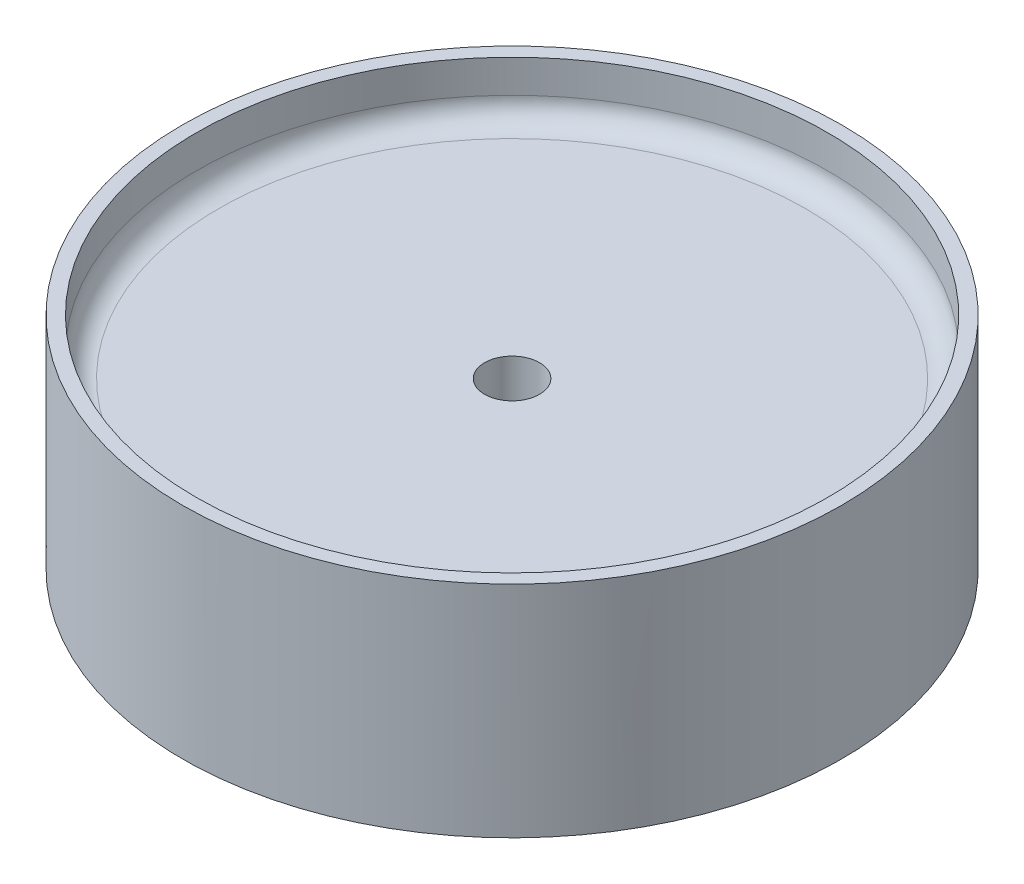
SolidWorks part; units mm, degrees
ref_plane "Front Plane" through (0, 0, 0) normal (0, 0, 1) x (1, 0, 0)
ref_plane "Top Plane" through (0, 0, 0) normal (0, 1, 0) x (1, 0, 0)
ref_plane "Right Plane" through (0, 0, 0) normal (1, 0, 0) x (0, 0, -1)
sketch "Sketch1" plane through (0, 0, 0) normal (0, 1, 0) x (1, 0, 0)
  circle A0 centre (0, 0) radius 38.1
  circle A2 centre (0, 0) radius 3.175
  dimension "D1" = 76.2
  dimension "D2" = 6.35
extrude "Boss-Extrude1" add sketch "Sketch1" along normal blind 12.7
sketch "Sketch2" plane through (0, 12.7, 0) normal (0, 1, 0) x (1, 0, 0)
  circle A0 centre (0, 0) radius 38.1
  circle A1 centre (0, 0) radius 36.5125
  dimension "D1" = 76.2
  dimension "D2" = 73.025
extrude "Boss-Extrude2" add sketch "Sketch2" along normal blind 6.35
sketch "Sketch3" plane through (0, 0, 0) normal (0, -1, 0) x (1, 0, 0)
  circle A0 centre (0, 0) radius 38.1
  circle A1 centre (0, 0) radius 36.5125
  dimension "D1" = 73.025
  dimension "D2" = 76.2
extrude "Boss-Extrude3" add sketch "Sketch3" along normal blind 6.35
fillet "Fillet1" radius 2.54 2 edges at (0, 0, -36.5125) (0, 12.7, 36.5125)
